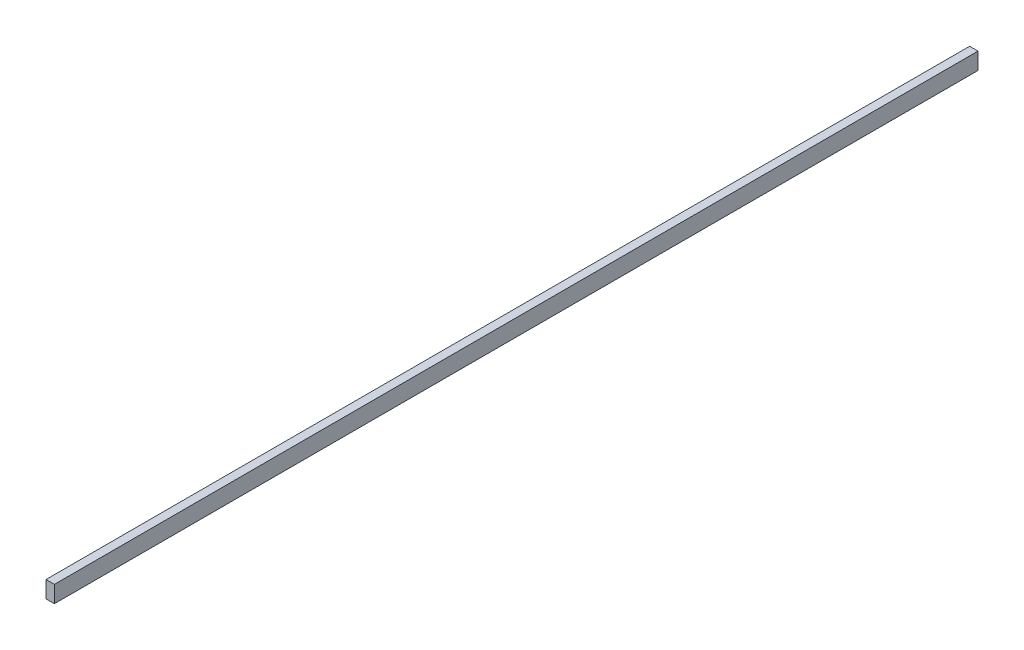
SolidWorks part; units mm, degrees
ref_plane "Face" through (0, 0, 0) normal (0, 0, 1) x (1, 0, 0)
ref_plane "Dessus" through (0, 0, 0) normal (0, 1, 0) x (1, 0, 0)
ref_plane "Droite" through (0, 0, 0) normal (1, 0, 0) x (0, 0, -1)
sketch "Esquisse1" plane through (0, 0, 0) normal (1, 0, 0) x (0, 0, -1)
  line L1 (0, 0) -> (550, 0)
  line L2 (0, 0) -> (0, 10)
  line L3 (0, 10) -> (550, 10)
  line L4 (550, 0) -> (550, 10)
  dimension "D1" = 550
  dimension "D2" = 10
extrude "Extrusion1" add sketch "Esquisse1" along normal blind 5
